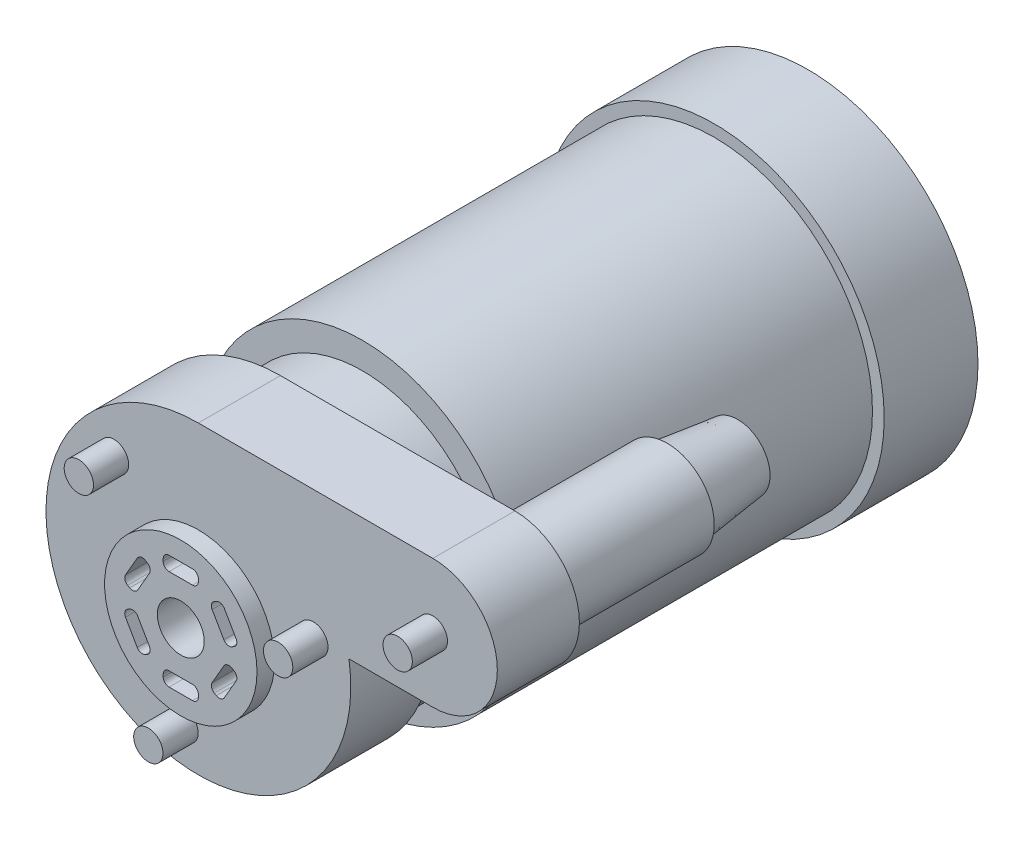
SolidWorks part; units mm, degrees
ref_plane "Plan de face" through (0, 0, 0) normal (0, 0, 1) x (1, 0, 0)
ref_plane "Plan de dessus" through (0, 0, 0) normal (0, 1, 0) x (1, 0, 0)
ref_plane "Plan de droite" through (0, 0, 0) normal (1, 0, 0) x (0, 0, -1)
sketch "Esquisse1" plane through (0, 0, 0) normal (0, 0, 1) x (1, 0, 0)
  line L0 (0, 13) -> (20, 13)
  line L1 (12.8452, 2) -> (20, 2)
  arc A0 (0, 13) -> (12.8452, 2) centre (0, 0) ccw
  arc A1 (20, 13) -> (20, 2) centre (20, 7.5) cw
  dimension "D1" = 26
  dimension "D2" = 20
  dimension "D3" = 11
extrude "Extrusion1" add sketch "Esquisse1" along normal blind 7
sketch "Esquisse2" plane through (0, 0, 7) normal (0, 0, 1) x (1, 0, 0)
  circle A0 centre (-7.1957, 6.9442) radius 1.25
  circle A1 centre (-1.2679, -9.9193) radius 1.25
  circle A2 centre (9.8046, 1.9672) radius 1.25
  circle A3 centre (20, 7.5) radius 1.25
  circle A4 centre (0, 0) radius 10 construction
  arc A5 (0, 13) -> (12.8452, 2) centre (0, 0) ccw construction
  dimension "D1" = 2.5
  dimension "D2" = 3
extrude "Extrusion2" add sketch "Esquisse2" along normal blind 3
sketch "Esquisse3" plane through (0, 0, 7) normal (0, 0, 1) x (1, 0, 0)
  circle A0 centre (0, -1.3909) radius 6.5
  dimension "D1" = 13
extrude "Extrusion3" add sketch "Esquisse3" along normal blind 1.5
sketch "Esquisse4" plane through (0, 0, 8.5) normal (0, 0, 1) x (1, 0, 0)
  line L0 (2.6748, 1.3081) -> (3.6748, -0.4239)
  line L1 (-1, 3.4751) -> (1, 3.4751)
  line L2 (-1.5, 2.9751) -> (-1.5, 2.7751)
  line L3 (-1, 2.2751) -> (1, 2.2751)
  line L4 (1.5, 2.9751) -> (1.5, 2.7751)
  line L5 (4.531, -0.507) -> (4.3578, -0.607)
  line L6 (3.7141, 1.9081) -> (4.7141, 0.1761)
  line L7 (3.031, 2.0911) -> (2.8578, 1.9911)
  line L8 (3.6748, -2.3579) -> (2.6748, -4.0899)
  line L9 (3.031, -4.8729) -> (2.8578, -4.7729)
  line L10 (4.7141, -2.9579) -> (3.7141, -4.6899)
  line L11 (4.531, -2.2749) -> (4.3578, -2.1749)
  line L12 (1, -5.0569) -> (-1, -5.0569)
  line L13 (-1.5, -5.7569) -> (-1.5, -5.5569)
  line L14 (1, -6.2569) -> (-1, -6.2569)
  line L15 (1.5, -5.7569) -> (1.5, -5.5569)
  line L16 (-2.6748, -4.0899) -> (-3.6748, -2.3579)
  line L17 (-4.531, -2.2749) -> (-4.3578, -2.1749)
  line L18 (-3.7141, -4.6899) -> (-4.7141, -2.9579)
  line L19 (-3.031, -4.8729) -> (-2.8578, -4.7729)
  line L20 (-3.6748, -0.4239) -> (-2.6748, 1.3081)
  line L21 (-3.031, 2.0911) -> (-2.8578, 1.9911)
  line L22 (-4.7141, 0.1761) -> (-3.7141, 1.9081)
  line L23 (-4.531, -0.507) -> (-4.3578, -0.607)
  circle A0 centre (0, -1.3909) radius 2
  arc A1 (-1, 3.4751) -> (-1.5, 2.9751) centre (-1, 2.9751) ccw
  arc A2 (1, 3.4751) -> (1.5, 2.9751) centre (1, 2.9751) cw
  arc A3 (1, 2.2751) -> (1.5, 2.7751) centre (1, 2.7751) ccw
  arc A4 (-1.5, 2.7751) -> (-1, 2.2751) centre (-1, 2.7751) ccw
  arc A5 (3.6748, -0.4239) -> (4.3578, -0.607) centre (4.1078, -0.1739) ccw
  arc A6 (4.7141, 0.1761) -> (4.531, -0.507) centre (4.281, -0.0739) cw
  arc A7 (3.7141, 1.9081) -> (3.031, 2.0911) centre (3.281, 1.6581) ccw
  arc A8 (2.8578, 1.9911) -> (2.6748, 1.3081) centre (3.1078, 1.5581) ccw
  arc A9 (2.6748, -4.0899) -> (2.8578, -4.7729) centre (3.1078, -4.3399) ccw
  arc A10 (3.7141, -4.6899) -> (3.031, -4.8729) centre (3.281, -4.4399) cw
  arc A11 (4.7141, -2.9579) -> (4.531, -2.2749) centre (4.281, -2.7079) ccw
  arc A12 (4.3578, -2.1749) -> (3.6748, -2.3579) centre (4.1078, -2.6079) ccw
  arc A13 (-1, -5.0569) -> (-1.5, -5.5569) centre (-1, -5.5569) ccw
  arc A14 (-1, -6.2569) -> (-1.5, -5.7569) centre (-1, -5.7569) cw
  arc A15 (1, -6.2569) -> (1.5, -5.7569) centre (1, -5.7569) ccw
  arc A16 (1.5, -5.5569) -> (1, -5.0569) centre (1, -5.5569) ccw
  arc A17 (-3.6748, -2.3579) -> (-4.3578, -2.1749) centre (-4.1078, -2.6079) ccw
  arc A18 (-4.7141, -2.9579) -> (-4.531, -2.2749) centre (-4.281, -2.7079) cw
  arc A19 (-3.7141, -4.6899) -> (-3.031, -4.8729) centre (-3.281, -4.4399) ccw
  arc A20 (-2.8578, -4.7729) -> (-2.6748, -4.0899) centre (-3.1078, -4.3399) ccw
  arc A21 (-2.6748, 1.3081) -> (-2.8578, 1.9911) centre (-3.1078, 1.5581) ccw
  arc A22 (-3.7141, 1.9081) -> (-3.031, 2.0911) centre (-3.281, 1.6581) cw
  arc A23 (-4.7141, 0.1761) -> (-4.531, -0.507) centre (-4.281, -0.0739) ccw
  arc A24 (-4.3578, -0.607) -> (-3.6748, -0.4239) centre (-4.1078, -0.1739) ccw
  point P9 (-1.5, 3.4751)
  point P12 (1.5, 3.4751)
  point P17 (-1.5, 2.2751)
  dimension "D2" = 4
  dimension "D5" = 0.5
  dimension "D1" = 1.2
  dimension "D3" = 3
  dimension "D4" = 1.5
extrude "Enlèv. mat.-Extru.1" cut sketch "Esquisse4" against normal up to next
sketch "Esquisse5" plane through (0, 0, 0) normal (0, 0, -1) x (-1, 0, 0)
  circle A0 centre (0, -1.3909) radius 11.25
  dimension "D1" = 22.5
extrude "Extrusion4" add sketch "Esquisse5" along normal blind 7
sketch "Esquisse6" plane through (0, 0, -7) normal (0, 0, -1) x (-1, 0, 0)
  circle A0 centre (0, -1.3909) radius 13.5
  circle A1 centre (0, -1.3909) radius 11.25 construction
  dimension "D1" = 27
extrude "Extrusion5" add sketch "Esquisse6" along normal blind 30
sketch "Esquisse7" plane through (0, 0, -37) normal (0, 0, -1) x (-1, 0, 0)
  circle A0 centre (0, -1.3909) radius 14.5
  circle A1 centre (0, -1.3909) radius 13.5 construction
  dimension "D1" = 29
extrude "Extrusion6" add sketch "Esquisse7" along normal blind 8
sketch "Esquisse8" plane through (0, 0, 0) normal (0, 0, -1) x (-1, 0, 0)
  circle A0 centre (-20, 7.5) radius 4
  arc A1 (-20, 13) -> (-20, 2) centre (-20, 7.5) ccw construction
  dimension "D1" = 8
extrude "Extrusion7" add sketch "Esquisse8" along normal blind 13
sketch "Esquisse9" plane through (0, 0, -13) normal (0, 0, -1) x (-1, 0, 0)
  circle A0 centre (-20, 7.5) radius 3.5
  circle A1 centre (-20, 7.5) radius 4 construction
  dimension "D1" = 7
extrude "Extrusion8" add sketch "Esquisse9" along normal blind 6
chamfer "Chanfrein1" distance 6 angle 7 1 edges at (16.5, 7.5, -19)
shell "Coque1" thickness 1
